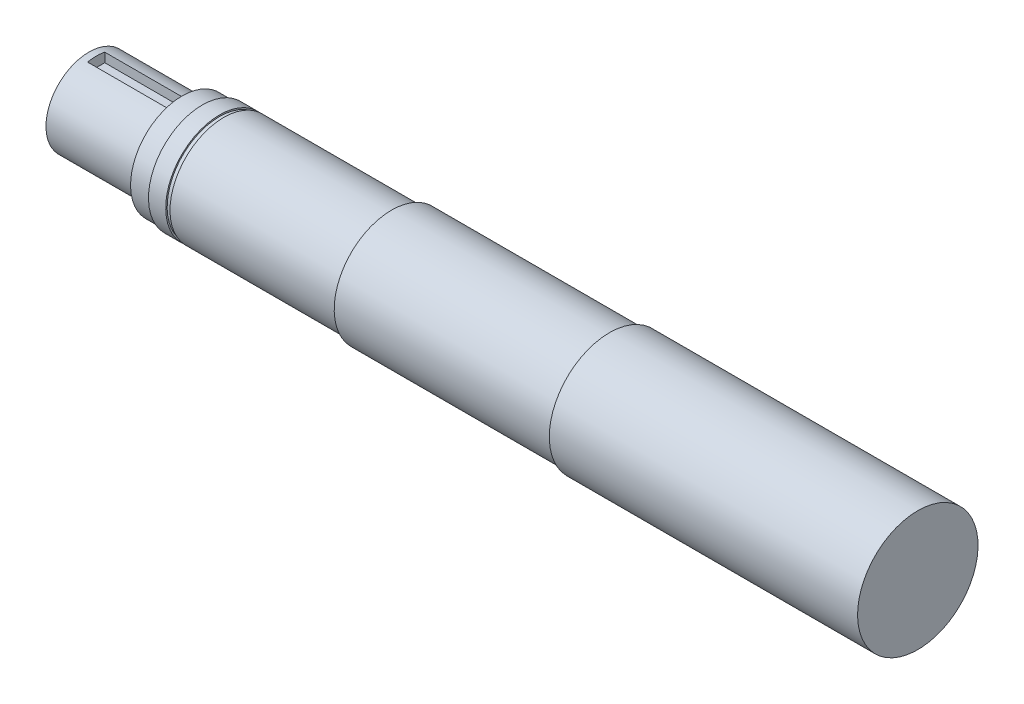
SolidWorks part; units mm, degrees
ref_plane "Front Plane" through (0, 0, 0) normal (0, 0, 1) x (1, 0, 0)
ref_plane "Top Plane" through (0, 0, 0) normal (0, 1, 0) x (1, 0, 0)
ref_plane "Right Plane" through (0, 0, 0) normal (1, 0, 0) x (0, 0, -1)
sketch "Sketch1" plane through (0, 0, 0) normal (0, 0, 1) x (1, 0, 0)
  line L0 (-367, 40) -> (-215, 40)
  line L1 (-215, 40) -> (-215, 42)
  line L2 (-215, 42) -> (0, 42)
  line L3 (0, 42) -> (0, 0)
  line L4 (0, 0) -> (-578, 0)
  line L5 (-499, 36) -> (-499, 37.5)
  line L6 (-367, 40) -> (-367, 37.5)
  line L7 (-367, 37.5) -> (-484, 37.5)
  line L8 (-499, 36) -> (-513, 36)
  line L9 (-513, 36) -> (-513, 30)
  line L10 (-513, 30) -> (-578, 30)
  line L11 (-578, 30) -> (-578, 0)
  line L12 (-487, 37.5) -> (-487, 36.5)
  line L13 (-484, 37.5) -> (-484, 36.5)
  line L14 (-484, 36.5) -> (-487, 36.5)
  line L15 (-487, 37.5) -> (-499, 37.5)
  dimension "D1" = 152
  dimension "D2" = 215
  dimension "D3" = 42
  dimension "D4" = 40
  dimension "D5" = 37.5
  dimension "D6" = 132
  dimension "D7" = 14
  dimension "D8" = 36
  dimension "D9" = 65
  dimension "D10" = 30
  dimension "D11" = 12
  dimension "D12" = 3
  dimension "D13" = 36.5
revolve "Revolve1" add sketch "Sketch1" angle 360 about L4
ref_plane "Plane1" through (0, 23, 0) normal (0, 1, 0) x (1, 0, 0)
sketch "Sketch3" plane through (0, 23, 0) normal (0, 1, 0) x (1, 0, 0)
  line L0 (-513, 30) -> (-513, -30) construction
  line L1 (-573, -6) -> (-513, -6)
  line L2 (-573, -6) -> (-573, 6)
  line L3 (-573, 6) -> (-513, 6)
  line L4 (-513, -6) -> (-513, 6)
  line L5 (-573, -6) -> (-513, 6) construction
  line L6 (-573, 6) -> (-513, -6) construction
  line L7 (0, 0) -> (-543, 0) construction
  point P0 (-543, 0)
  dimension "D1" = 60
  dimension "D2" = 12
extrude "Cut-Extrude1" cut sketch "Sketch3" along normal through all
equation "\"37.5.00mm\"=35"
